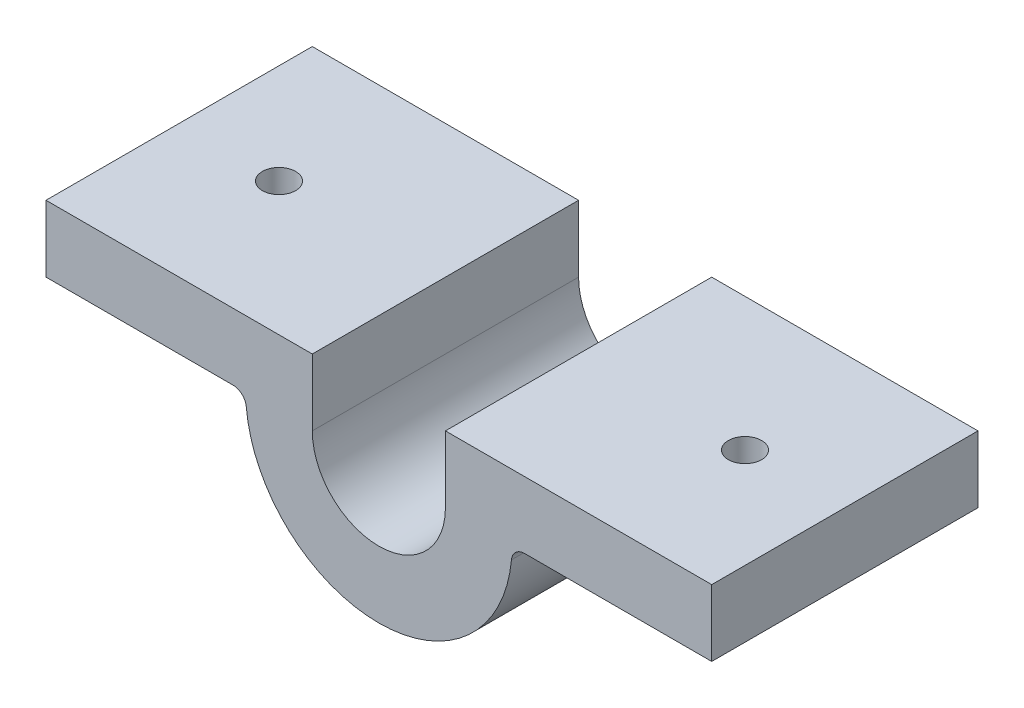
SolidWorks part; units mm, degrees
ref_plane "Front Plane" through (0, 0, 0) normal (0, 0, 1) x (1, 0, 0)
ref_plane "Top Plane" through (0, 0, 0) normal (0, 1, 0) x (1, 0, 0)
ref_plane "Right Plane" through (0, 0, 0) normal (1, 0, 0) x (0, 0, -1)
sketch "Sketch1" plane through (0, 0, 0) normal (0, 0, 1) x (1, 0, 0)
  line L0 (-25, 5) -> (-5, 5)
  line L1 (-5, 5) -> (-5, 0)
  line L2 (5, 5) -> (5, 0)
  line L3 (5, 5) -> (25, 5)
  line L4 (-25, 0) -> (-10, 0)
  line L5 (-10, 0) -> (-10, 0)
  line L6 (10, 0) -> (10, 0)
  line L7 (10, 0) -> (25, 0)
  line L8 (-25, 5) -> (-25, 0)
  line L9 (25, 5) -> (25, 0)
  arc A0 (-5, 0) -> (5, 0) centre (0, 0) ccw
  arc A1 (-10, 0) -> (10, 0) centre (0, 0) ccw
  dimension "D1" = 10
  dimension "D2" = 20
  dimension "D3" = 20
  dimension "D4" = 5
extrude "Boss-Extrude1" add sketch "Sketch1" against normal blind 20
sketch "Sketch2" plane through (0, 0, 0) normal (0, -1, 0) x (-1, 0, 0)
  line L0 (25, 0) -> (10, 0) construction
  line L1 (25, 20) -> (25, 0) construction
  line L2 (-10, 0) -> (-25, 0) construction
  circle A0 centre (17.5, 10) radius 1.25
  circle A1 centre (-17.5, 10) radius 1.25
  point P4 (0, 0)
  point P7 (17.5, 0)
  point P8 (0, 0)
  point P11 (25, 10)
  point P12 (0, 0)
  point P13 (0, 0)
  point P16 (-17.5, 0)
  dimension "D1" = 2.5
extrude "Cut-Extrude1" cut sketch "Sketch2" against normal blind 20
fillet "Fillet1" radius 1 2 edges at (10, 0, -10) (-10, 0, -10)
